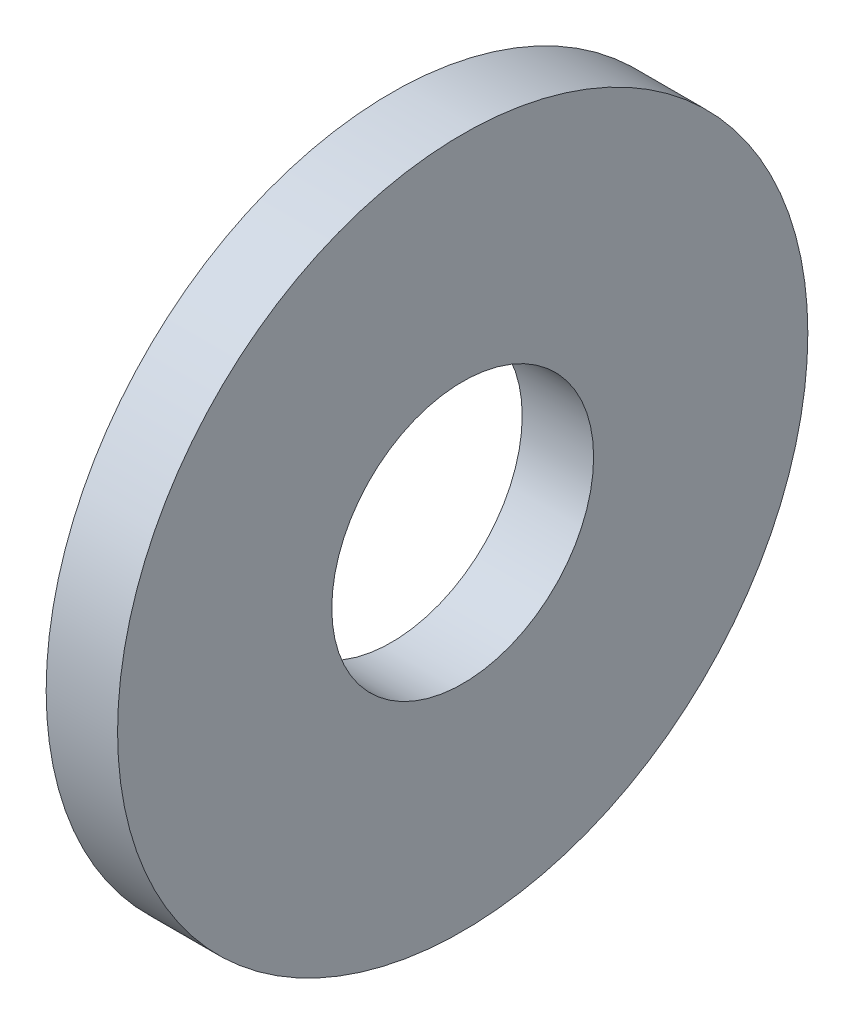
SolidWorks part; units mm, degrees
ref_plane "Plane1" through (0, 0, 0) normal (0, 0, 1) x (1, 0, 0)
ref_plane "Plane2" through (0, 0, 0) normal (0, 1, 0) x (1, 0, 0)
ref_plane "Plane3" through (0, 0, 0) normal (1, 0, 0) x (0, 0, -1)
other "Configuration Table"
sketch "Sketch1" plane through (0, 0, 0) normal (1, 0, 0) x (0, 0, -1)
  circle A0 centre (0, 0) radius 5.5
  circle A1 centre (0, 0) radius 14.5
  dimension "Insid_Dia" = 11
  dimension "OutsideDia" = 29
extrude "Base-Extrude" add sketch "Sketch1" along normal blind 3
